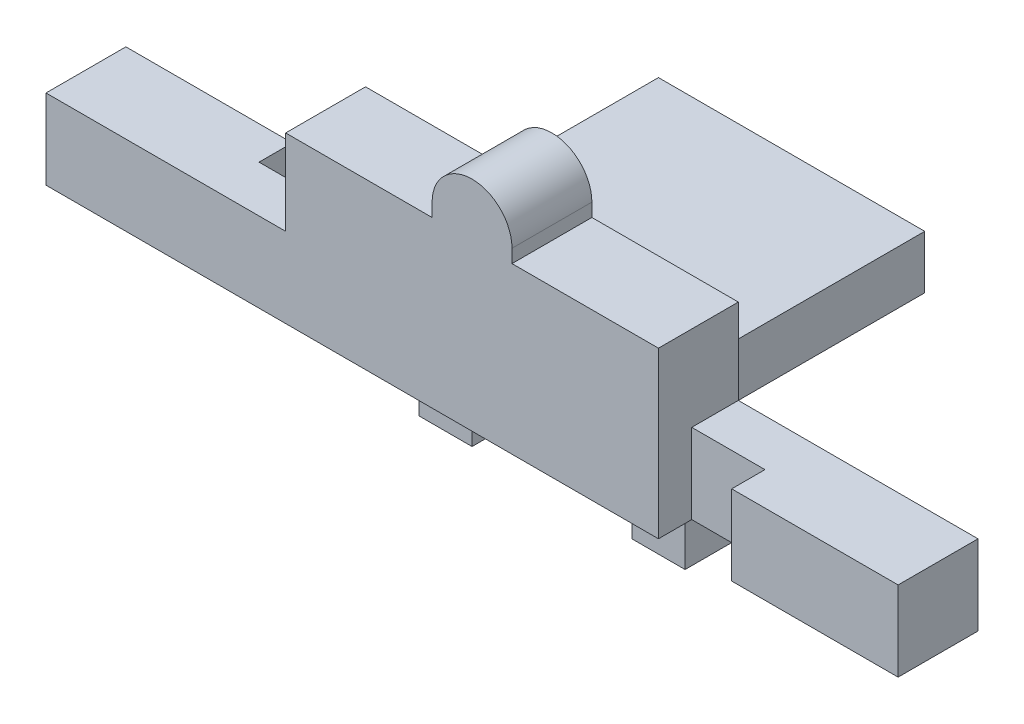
SolidWorks part; units mm, degrees
ref_plane "Front Plane" through (0, 0, 0) normal (0, 0, 1) x (1, 0, 0)
ref_plane "Top Plane" through (0, 0, 0) normal (0, 1, 0) x (1, 0, 0)
ref_plane "Right Plane" through (0, 0, 0) normal (1, 0, 0) x (0, 0, -1)
sketch "Sketch2" plane through (0, 0, 0) normal (0, 0, 1) x (1, 0, 0)
  line L0 (0, 0) -> (-14, 0)
  line L1 (-14, 0) -> (-14, 5.2)
  line L2 (-14, 5.2) -> (0, 5.2)
  line L4 (0, 5.2) -> (0, 0)
  line L5 (-7, 5.7) -> (-7, 4.7) construction
  line L6 (-5.5, 5.7) -> (-5.5, 4.7)
  line L7 (-8.5, 5.7) -> (-8.5, 4.7)
  arc A0 (-5.5, 5.7) -> (-8.5, 5.7) centre (-7, 5.7) ccw
  arc A1 (-8.5, 4.7) -> (-5.5, 4.7) centre (-7, 4.7) ccw
  point P9 (-7, 5.2)
  dimension "D1" = 1.5
  dimension "D2" = 1
  dimension "D3" = 14
  dimension "D4" = 5.2
extrude "Boss-Extrude1" add sketch "Sketch2" along normal blind 3
sketch "Sketch3" plane through (0, 0, 0) normal (0, -1, 0) x (1, 0, 0)
  line L0 (0, 3) -> (-14, 3) construction
  line L1 (-12, 3) -> (-2, 3)
  line L2 (-12, 3) -> (-12, -9)
  line L3 (-12, -9) -> (-2, -9)
  line L4 (-2, 3) -> (-2, -9)
  line L5 (0, 0) -> (-14, 0) construction
  point P6 (-7, -9)
  point P9 (-7, 0)
  dimension "D1" = 12
  dimension "D2" = 10
extrude "Boss-Extrude2" add sketch "Sketch3" against normal blind 2
sketch "Sketch4" plane through (0, 0, 0) normal (0, -1, 0) x (1, 0, 0)
  line L0 (-12, 0) -> (-14, 0) construction
  line L1 (-14, 3) -> (-23, 3)
  line L2 (-14, 3) -> (-14, 0)
  line L3 (-14, 0) -> (-23, 0)
  line L4 (-23, 3) -> (-23, 0)
  line L11 (0, 3) -> (-14, 3) construction
  line L12 (0, 3) -> (9, 3)
  line L13 (9, 3) -> (9, 0)
  line L14 (9, 0) -> (0, 0)
  line L15 (0, 0) -> (0, 3)
  line L27 (-16.75, 1.25) -> (-14, 1.25)
  line L28 (-16.75, 1.25) -> (-16.75, 0)
  line L29 (-16.75, 0) -> (-14, 0)
  line L30 (-14, 1.25) -> (-14, 0)
  line L31 (0, 3) -> (2.75, 3)
  line L32 (0, 3) -> (0, 1.75)
  line L33 (0, 1.75) -> (2.75, 1.75)
  line L34 (2.75, 3) -> (2.75, 1.75)
  point P5 (-14.75, 1.5)
  dimension "D1" = 9
  dimension "D2" = 2.75
  dimension "D4" = 9
  dimension "D7" = 1.25
extrude "Boss-Extrude3" add sketch "Sketch4" against normal blind 2 and the other way blind 1
sketch "Sketch6" plane through (0, 0, 0) normal (0, -1, 0) x (1, 0, 0)
  line L1 (-12, 0) -> (-10, 0)
  line L2 (-12, 0) -> (-12, -1.7544)
  line L3 (-12, -1.7544) -> (-10, -1.7544)
  line L4 (-10, 0) -> (-10, -1.7544)
  line L5 (-2, 0) -> (-4, 0)
  line L6 (-2, 0) -> (-2, -1.75)
  line L7 (-2, -1.75) -> (-4, -1.75)
  line L8 (-4, 0) -> (-4, -1.75)
  dimension "D1" = 2
  dimension "D2" = 2
  dimension "D3" = 1.75
extrude "Boss-Extrude4" add sketch "Sketch6" along normal blind 4.5
sketch "Sketch7" plane through (0, 0, 0) normal (0, -1, 0) x (1, 0, 0)
  line L1 (-14, 3) -> (0, 3)
  line L2 (-14, 3) -> (-14, 0)
  line L3 (-14, 0) -> (0, 0)
  line L4 (0, 3) -> (0, 0)
extrude "Boss-Extrude5" add sketch "Sketch7" along normal blind 1
